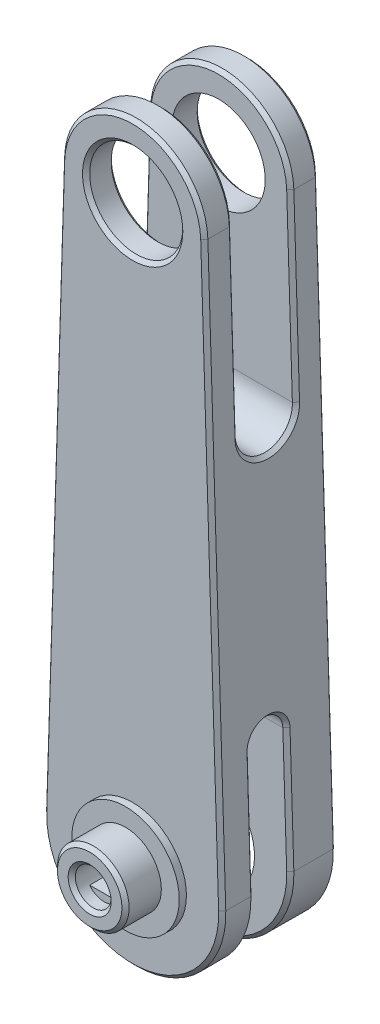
SolidWorks part; units mm, degrees
ref_plane "前视" through (0, 0, 0) normal (0, 0, 1) x (1, 0, 0)
ref_plane "上视" through (0, 0, 0) normal (0, 1, 0) x (1, 0, 0)
ref_plane "右视" through (0, 0, 0) normal (1, 0, 0) x (0, 0, -1)
sketch "草图1" plane through (0, 0, 0) normal (0, 0, 1) x (1, 0, 0)
  line L0 (0, 0) -> (0, 80) construction
  line L1 (-9.9951, 80.3125) -> (-12.4939, 0.3906)
  line L2 (9.9951, 80.3125) -> (12.4939, 0.3906)
  circle A0 centre (0, 0) radius 1.5
  arc A1 (-12.4939, 0.3906) -> (12.4939, 0.3906) centre (0, 0) ccw
  arc A2 (9.9951, 80.3125) -> (-9.9951, 80.3125) centre (0, 80) ccw
  circle A3 centre (0, 80) radius 6.5
  dimension "D1" = 80
  dimension "D2" = 3
  dimension "D3" = 13
  dimension "D4" = 20
  dimension "D5" = 25
extrude "凸台-拉伸1" add sketch "草图1" along normal mid plane 16
sketch "草图2" plane through (0, 0, 8) normal (0, 0, 1) x (1, 0, 0)
  circle A0 centre (0, 0) radius 5
  circle A1 centre (0, 0) radius 1.5 construction
  circle A2 centre (0, 0) radius 1.5
  dimension "D1" = 10
extrude "凸台-拉伸2" add sketch "草图2" along normal blind 6
sketch "草图3" plane through (0, 0, -8) normal (0, 0, -1) x (-1, 0, 0)
  circle A0 centre (0, 0) radius 9.5
  dimension "D1" = 19
extrude "切除-拉伸1" cut sketch "草图3" against normal blind 5
sketch "草图4" plane through (0, 0, -3) normal (0, 0, -1) x (-1, 0, 0)
  circle A0 centre (0, 0) radius 7.5
  dimension "D1" = 15
extrude "切除-拉伸2" cut sketch "草图4" against normal blind 2
sketch "草图5" plane through (0, 0, 0) normal (1, 0, 0) x (0, 0, -1)
  line L0 (0, 90) -> (0, -19.8534) construction
  line L1 (-1, -12.296) -> (-1, 17.5) construction
  line L2 (-8, -12.5) -> (8, -12.5) construction
  line L3 (-3.5, -12.296) -> (-3.5, 17.5)
  line L4 (1.5, -12.296) -> (1.5, 17.5)
  line L5 (8, 90) -> (-8, 90) construction
  line L6 (0, 90) -> (0, 55) construction
  line L7 (4, 90) -> (4, 55)
  line L8 (-4, 90) -> (-4, 55)
  line L9 (8, 0.3906) -> (8, 80.3125) construction
  arc A0 (-3.5, -12.296) -> (1.5, -12.296) centre (-1, -12.296) ccw
  arc A1 (1.5, 17.5) -> (-3.5, 17.5) centre (-1, 17.5) ccw
  arc A2 (4, 90) -> (-4, 90) centre (0, 90) ccw
  arc A3 (-4, 55) -> (4, 55) centre (0, 55) ccw
  point P7 (-1, 2.602)
  point P12 (0, 72.5)
  dimension "D1" = 5
  dimension "D2" = 30
  dimension "D3" = 8
  dimension "D4" = 35
  dimension "D5" = 6.5
  dimension "D6" = 9
extrude "切除-拉伸3" cut sketch "草图5" against normal mid plane 55
sketch "草图6" plane through (0, 0, 14) normal (0, 0, 1) x (1, 0, 0)
  line L0 (0, 0) -> (0, 6.4421) construction
  line L1 (0, 0) -> (-6.9033, 0) construction
  line L2 (-2, 1.5) -> (2, 1.5)
  line L3 (-2, -1.5) -> (2, -1.5)
  arc A0 (-2, 1.5) -> (-2, -1.5) centre (0, 0) ccw
  arc A1 (2, -1.5) -> (2, 1.5) centre (0, 0) ccw
  dimension "D1" = 2.5
  dimension "D2" = 3
extrude "切除-拉伸4" cut sketch "草图6" against normal through all
sketch "草图7" plane through (0, 0, 14) normal (0, 0, 1) x (1, 0, 0)
  circle A0 centre (0, 0) radius 2.5
  dimension "D1" = 5
extrude "切除-拉伸5" cut sketch "草图7" against normal blind 2
chamfer "倒角1" distance 0.5 angle 45 34 edges at (6.5, 80, -8) (-9.5, 0, -8) (-10.3908, 67.6562, -4) (-10.9116, 51, 0) (-10.3908, 67.6562, 4) (5, 0, 14) (2.5, 0, 14) (6.5, 80, 8) (6.5, 80, 4) (0, 90, 8) (-11.2445, 40.3516, 8) (0, -12.5, 8) (11.2445, 40.3516, 8) (0, 90, 4) (0, 90, -4) (10.3908, 67.6562, 4) (10.9116, 51, 0) (10.3908, 67.6562, -4) (0, 90, -8) (-11.2445, 40.3516, -8) (0, -12.5, -8) (11.2445, 40.3516, -8) (-12.2264, 8.9453, -1.5) (-11.8808, 20, 1) (-12.2264, 8.9453, 3.5) (-9.7251, -7.8531, -1.5) (-0.314, -12.4961, 3.492) (9.7251, -7.8531, -1.5) (-9.7251, -7.8531, 3.5) (9.7251, -7.8531, 3.5) (12.2264, 8.9453, -1.5) (11.8808, 20, 1) (12.2264, 8.9453, 3.5)
sketch "草图8" plane through (0, 0, 8) normal (0, 0, 1) x (1, 0, 0)
  circle A0 centre (0, 0) radius 7.5
  circle A1 centre (0, 0) radius 5 construction
  circle A2 centre (0, 0) radius 5
  dimension "D1" = 15
extrude "凸台-拉伸3" add sketch "草图8" along normal blind 1
